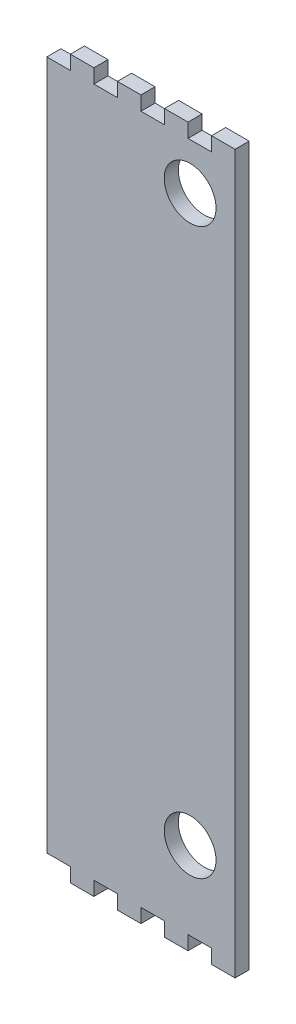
SolidWorks part; units mm, degrees
ref_plane "Piano frontale" through (0, 0, 0) normal (0, 0, 1) x (1, 0, 0)
ref_plane "Piano superiore" through (0, 0, 0) normal (0, 1, 0) x (1, 0, 0)
ref_plane "Piano destro" through (0, 0, 0) normal (1, 0, 0) x (0, 0, -1)
sketch "Schizzo1" plane through (0, 0, 0) normal (0, 0, 1) x (1, 0, 0)
  line L4 (-40, 143) -> (-40, -150)
  line L43 (40, 0) -> (-40, 0) construction
  line L44 (-20, -156) -> (-30, -156)
  line L45 (0, -156) -> (-10, -156)
  line L46 (20, -156) -> (10, -156)
  line L47 (30, -156) -> (30, -150)
  line L48 (30, -150) -> (20, -150)
  line L49 (20, -156) -> (20, -150)
  line L50 (10, -156) -> (10, -150)
  line L51 (10, -150) -> (0, -150)
  line L52 (0, -156) -> (0, -150)
  line L53 (-10, -156) -> (-10, -150)
  line L54 (-10, -150) -> (-20, -150)
  line L55 (-20, -156) -> (-20, -150)
  line L56 (-30, -156) -> (-30, -150)
  line L57 (-30, -150) -> (-40, -150)
  line L58 (-20, 149) -> (-30, 149)
  line L59 (20, 149) -> (10, 149)
  line L60 (-30, 143) -> (-40, 143)
  line L61 (-30, 149) -> (-30, 143)
  line L62 (-10, 143) -> (-20, 143)
  line L63 (-20, 149) -> (-20, 143)
  line L64 (-10, 149) -> (-10, 143)
  line L65 (10, 143) -> (0, 143)
  line L66 (0, 149) -> (0, 143)
  line L67 (10, 149) -> (10, 143)
  line L68 (20, 149) -> (20, 143)
  line L69 (30, 143) -> (20, 143)
  line L70 (30, 149) -> (30, 143)
  line L71 (0, 149) -> (-10, 149)
  line L72 (40, -156) -> (30, -156)
  line L73 (40, 149) -> (40, -156)
  line L74 (40, 149) -> (30, 149)
  dimension "D1" = 305
  dimension "D2" = 6
  dimension "D3" = 6
extrude "Estrusione-Estrusione1" add sketch "Schizzo1" along normal blind 6
sketch "Schizzo2" plane through (0, 0, 6) normal (0, 0, 1) x (1, 0, 0)
  circle A0 centre (20.8937, -116.7563) radius 11.0009
  circle A1 centre (20.8937, 123.2437) radius 11.0009
extrude "Taglio-Estrusione1" cut sketch "Schizzo2" against normal through all
